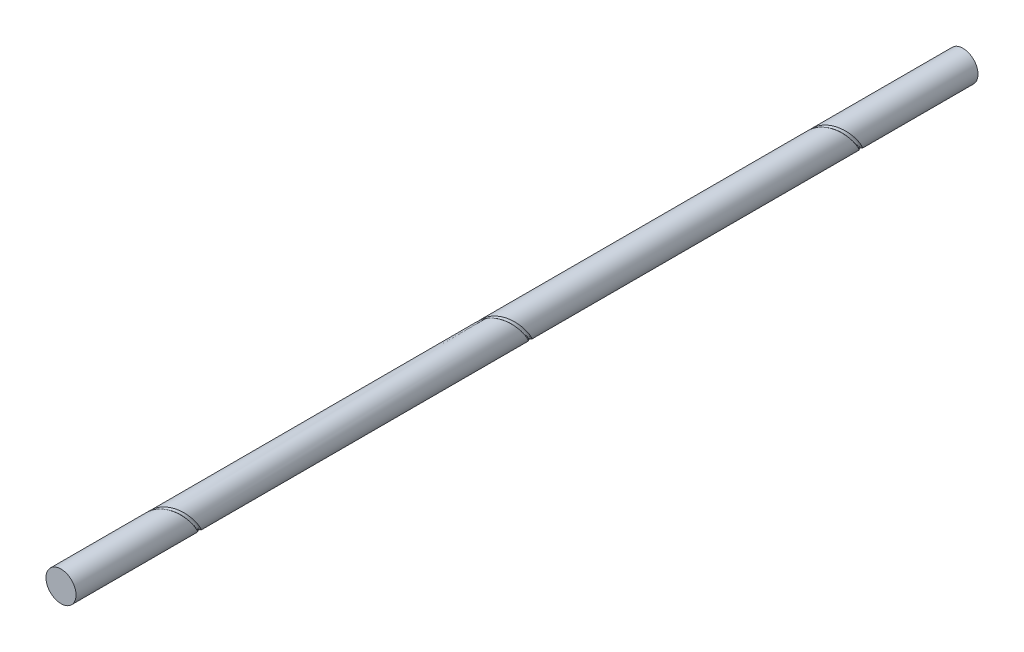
SolidWorks part; units mm, degrees
ref_plane "Front Plane" through (0, 0, 0) normal (0, 0, 1) x (1, 0, 0)
ref_plane "Top Plane" through (0, 0, 0) normal (0, 1, 0) x (1, 0, 0)
ref_plane "Right Plane" through (0, 0, 0) normal (1, 0, 0) x (0, 0, -1)
sketch "Sketch1" plane through (0, 0, 0) normal (0, 0, 1) x (1, 0, 0)
  circle A0 centre (0, 0) radius 25
  dimension "D1" = 50
extrude "Boss-Extrude1" add sketch "Sketch1" along normal blind 1500
ref_plane "Plane1" through (0, 0, 150) normal (0, 0, 1) x (1, 0, 0)
sketch "Sketch2" plane through (0, 0, 150) normal (0, 0, 1) x (1, 0, 0)
  circle A0 centre (0, 0) radius 27.646
  dimension "D1" = 55.292
curve "Helix/Spiral1"
sketch "Sketch3" plane through (0, 0, 0) normal (0, 1, 0) x (1, 0, 0)
  circle A0 centre (-27.646, -150) radius 3.969
  spline S0 degree 3 poles (-27.646, -150) (-27.646, -151.3307) (-27.0608, -154.0012) (-24.4828, -157.9997) (-20.3663, -162.0001) (-14.9702, -166) (-8.6335, -170) (-1.7543, -174) (5.2352, -178) (11.8957, -182) (17.8087, -186) (22.6028, -190) (25.9766, -194) (27.7183, -198) (27.7183, -202) (25.9766, -206) (22.6028, -210) (17.8087, -214) (11.8957, -218) (5.2352, -222) (-1.7543, -226) (-8.6335, -230) (-14.9702, -234) (-20.3663, -237.9999) (-24.4828, -242.0003) (-27.0608, -245.9988) (-27.646, -248.6693) (-27.646, -250) knots 0 0 0 0 0.04 0.08 0.12 0.16 0.2 0.24 0.28 0.32 0.36 0.4 0.44 0.48 0.52 0.56 0.6 0.64 0.68 0.72 0.76 0.8 0.84 0.88 0.92 0.96 1 1 1 1 construction
  dimension "D1" = 7.938
sweep "Cut-Sweep1" cut profiles "Sketch3" path "Helix/Spiral1"
pattern_linear "LPattern1" count 3 spacing 550 along (0, 0, -1) of "Cut-Sweep1"
